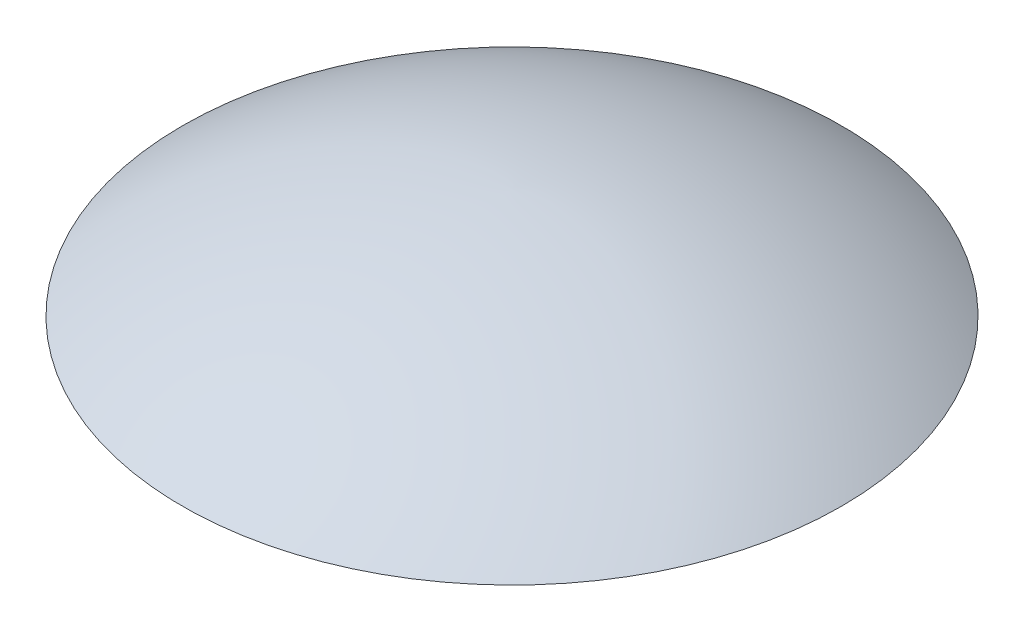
SolidWorks part; units mm, degrees
ref_plane "Front Plane" through (0, 0, 0) normal (0, 0, 1) x (1, 0, 0)
ref_plane "Top Plane" through (0, 0, 0) normal (0, 1, 0) x (1, 0, 0)
ref_plane "Right Plane" through (0, 0, 0) normal (1, 0, 0) x (0, 0, -1)
sketch "Sketch1" plane through (0, 0, 0) normal (0, 0, 1) x (1, 0, 0)
  line L0 (0, 20) -> (0, 0)
  line L1 (0, 0) -> (-60, 0)
  arc A0 (-60, 0) -> (0, 20) centre (2.3043, -86.9129) cw
  dimension "D1" = 60
  dimension "D2" = 20
revolve "Revolve2" add sketch "Sketch1" angle 360 about L0
sketch "Sketch2" plane through (0, 0, 0) normal (0, -1, 0) x (1, 0, 0)
  circle A0 centre (0, 0) radius 0.3648
shell "Shell3" thickness 3
